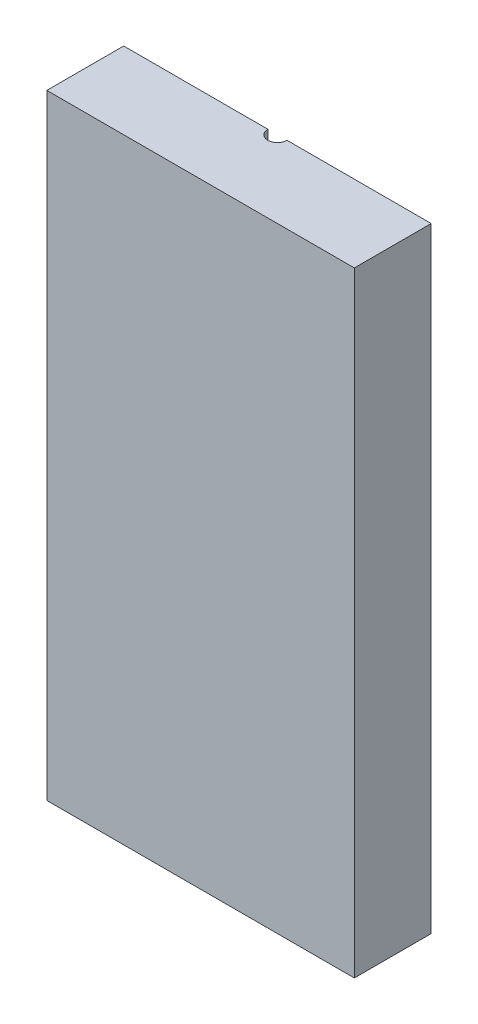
SolidWorks part; units mm, degrees
ref_plane "Front Plane" through (0, 0, 0) normal (0, 0, 1) x (1, 0, 0)
ref_plane "Top Plane" through (0, 0, 0) normal (0, 1, 0) x (1, 0, 0)
ref_plane "Right Plane" through (0, 0, 0) normal (1, 0, 0) x (0, 0, -1)
sketch "Sketch1" plane through (0, 0, 0) normal (0, 1, 0) x (1, 0, 0)
  line L0 (0.7937, 3.175) -> (12.7, 3.175)
  line L1 (-12.7, -3.175) -> (12.7, -3.175)
  line L2 (-12.7, -3.175) -> (-12.7, 3.175)
  line L3 (-12.7, 3.175) -> (-0.7938, 3.175)
  line L4 (12.7, -3.175) -> (12.7, 3.175)
  line L5 (-12.7, -3.175) -> (12.7, 3.175) construction
  line L6 (-12.7, 3.175) -> (12.7, -3.175) construction
  line L7 (0, 3.175) -> (0, 0) construction
  arc A0 (-0.7938, 3.175) -> (0.7937, 3.175) centre (0, 3.175) ccw
  point P0 (0, 0)
  point P9 (0, 0)
extrude "Boss-Extrude1" add sketch "Sketch1" along normal blind 50.8
equation "\"D1@Sketch1\"=1/16"
